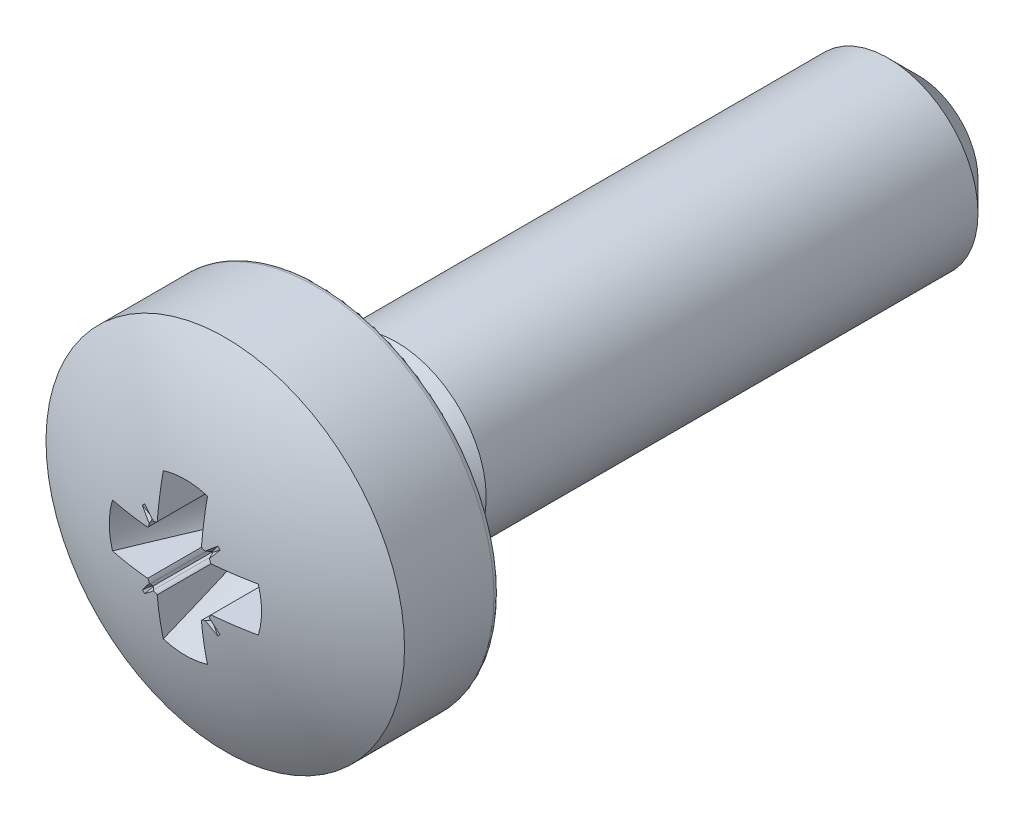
SolidWorks part; units mm, degrees
ref_plane "Plan1" through (0, 0, 0) normal (0, 0, 1) x (1, 0, 0)
ref_plane "Plan2" through (0, 0, 0) normal (0, 1, 0) x (1, 0, 0)
ref_plane "Plan3" through (0, 0, 0) normal (1, 0, 0) x (0, 0, -1)
imported_body "Vis à métaux - tête cylindrique bombée large DIN 7985 - M3x10 - 4,8"
chamfer "Chanfrein1" distance 0.5 angle 45
